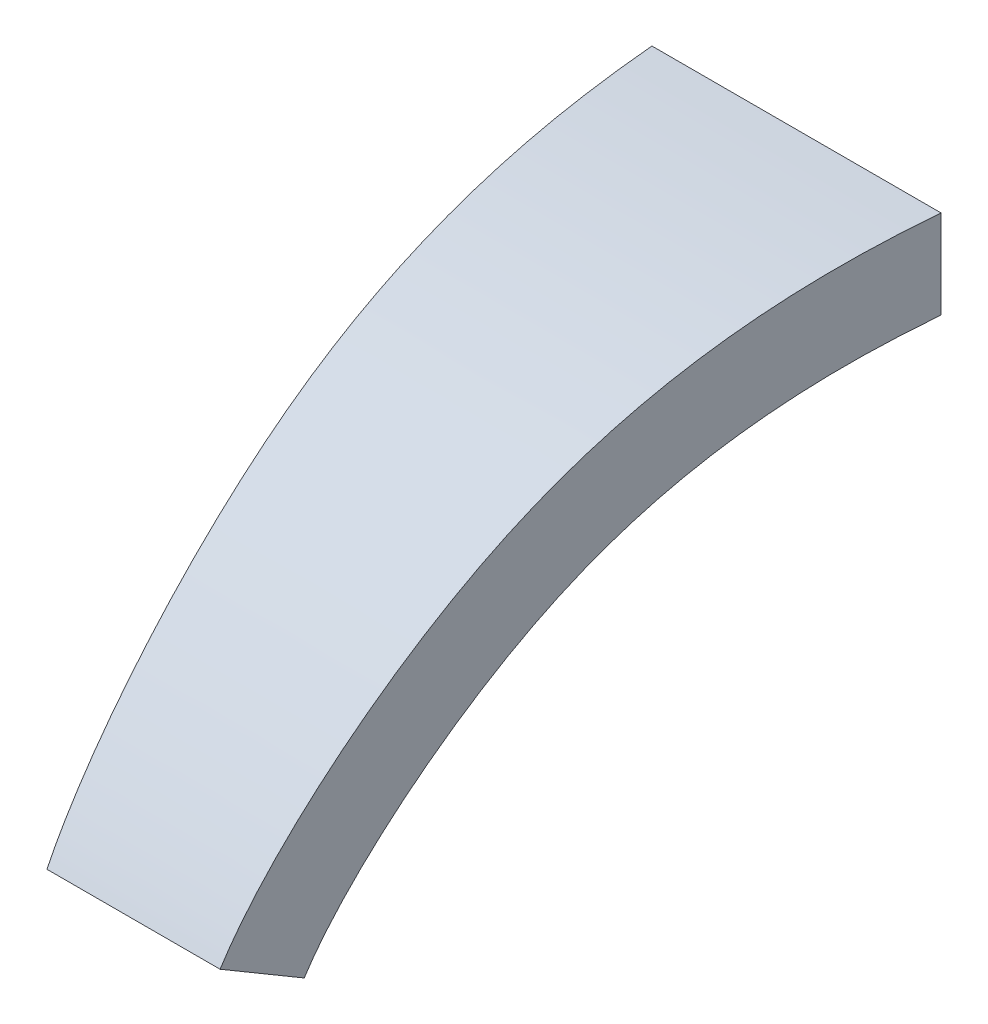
SolidWorks part; units mm, degrees
ref_plane "Front Plane" through (0, 0, 0) normal (0, 0, 1) x (1, 0, 0)
ref_plane "Top Plane" through (0, 0, 0) normal (0, 1, 0) x (1, 0, 0)
ref_plane "Right Plane" through (0, 0, 0) normal (1, 0, 0) x (0, 0, -1)
sketch "Sketch1" plane through (0, 0, 0) normal (1, 0, 0) x (0, 0, -1)
  line L0 (0, 0) -> (0, -30.48) construction
  line L1 (0, -30.48) -> (-57.3278, -30.48) construction
  line L2 (-0.1787, 0) -> (2.3871, 0) construction
  spline S0 degree 3 poles (0, 0) (-11.7263, 0) (-33.9709, -3.5745) (-53.5515, -23.6673) (-57.3278, -30.48) knots 0 0 0 0 0.526026 1 1 1 1
  dimension "D1" = 57.3278
  dimension "D2" = 30.48
extrude "Extrude-Thin1" add sketch "Sketch1" along normal mid plane 25 thin
draft "Draft1" type of draft neutral plane draft angle 5 faces to draft 2 parameters "D1"=5
